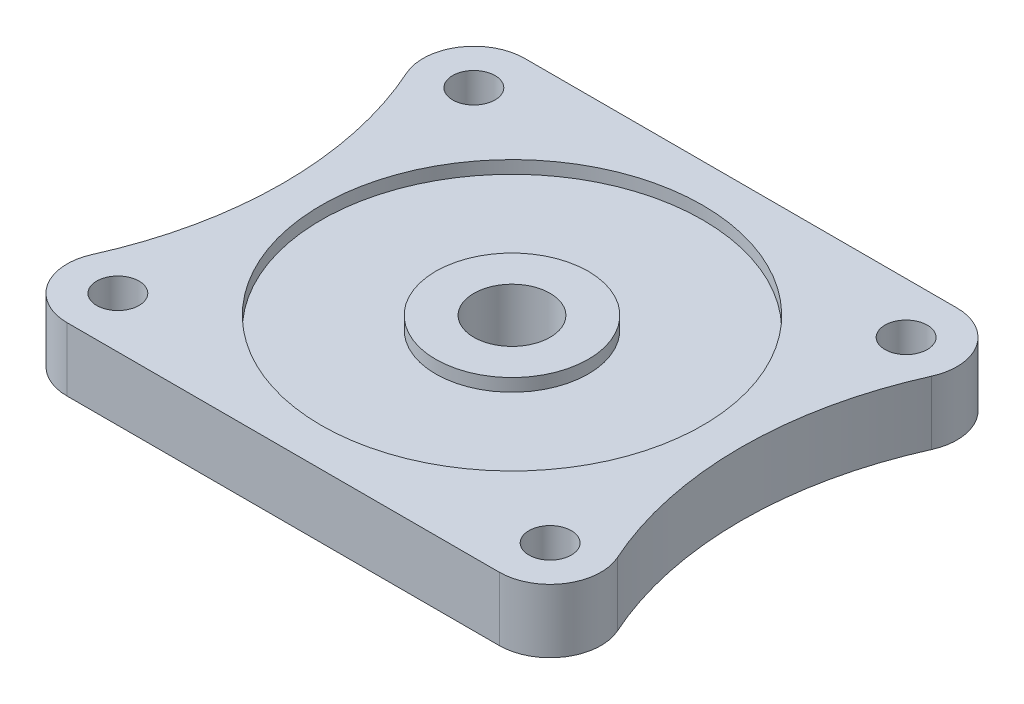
SolidWorks part; units mm, degrees
ref_plane "Front" through (0, 0, 0) normal (0, 0, 1) x (1, 0, 0)
ref_plane "Top" through (0, 0, 0) normal (0, 1, 0) x (1, 0, 0)
ref_plane "Right" through (0, 0, 0) normal (1, 0, 0) x (0, 0, -1)
sketch "Sketch1" plane through (0, 0, 0) normal (0, 1, 0) x (1, 0, 0)
  line L0 (-144.5, 0) -> (0, 0) construction
  line L1 (51, -42) -> (-51, -42) construction
  line L2 (51, -42) -> (51, 42) construction
  line L3 (51, 42) -> (-51, 42) construction
  line L4 (-51, -42) -> (-51, 42) construction
  line L5 (51, -42) -> (-51, 42) construction
  line L6 (51, 42) -> (-51, -42) construction
  line L7 (0, 0) -> (0, 54) construction
  line L8 (-51, 54) -> (51, 54)
  line L9 (-51, -54) -> (51, -54)
  circle A0 centre (-51, 42) radius 5
  arc A1 (61.9463, 37.0829) -> (51, 54) centre (51, 42) ccw
  arc A2 (51, -54) -> (61.9463, -37.0829) centre (51, -42) ccw
  arc A3 (-61.9463, -37.0829) -> (-51, -54) centre (-51, -42) ccw
  circle A4 centre (0, 0) radius 54 construction
  arc A5 (-61.9463, -37.0829) -> (-61.9463, 37.0829) centre (-144.5, 0) ccw
  arc A6 (61.9463, -37.0829) -> (61.9463, 37.0829) centre (144.5, 0) cw
  arc A7 (-51, 54) -> (-61.9463, 37.0829) centre (-51, 42) ccw
  circle A8 centre (51, 42) radius 5
  circle A9 centre (51, -42) radius 5
  circle A10 centre (-51, -42) radius 5
  point P0 (0, 0)
  dimension "D3" = 10
  dimension "D4" = 108
  dimension "D1" = 102
  dimension "D2" = 84
extrude "Boss-Extrude1" add sketch "Sketch1" along normal mid plane 15
sketch "Sketch2" plane through (0, 7.5, 0) normal (0, 1, 0) x (1, 0, 0)
  circle A0 centre (0, 0) radius 9
  dimension "D1" = 18
extrude "Cut-Extrude1" cut sketch "Sketch2" against normal through all
sketch "Sketch3" plane through (0, 7.5, 0) normal (0, 1, 0) x (1, 0, 0)
  circle A0 centre (0, 0) radius 18
  circle A1 centre (0, 0) radius 45
  dimension "D1" = 36
  dimension "D2" = 90
extrude "Cut-Extrude2" cut sketch "Sketch3" against normal blind 3
mirror "Mirror1" about plane through (0, 0, 0) normal (0, 1, 0) of "Cut-Extrude2"
